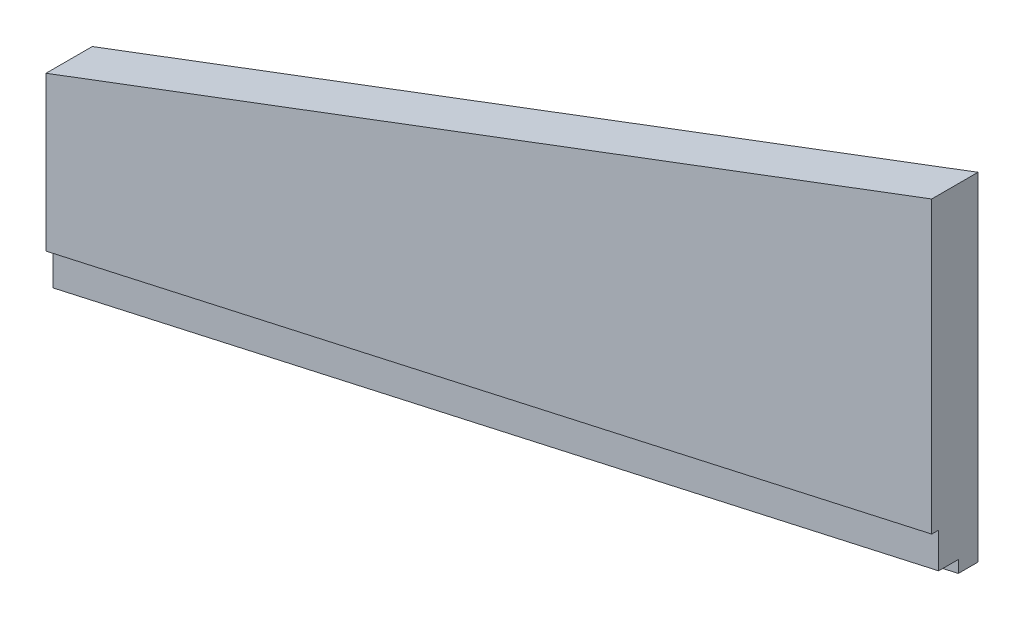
SolidWorks part; units mm, degrees
ref_plane "Спереди" through (0, 0, 0) normal (0, 0, 1) x (1, 0, 0)
ref_plane "Сверху" through (0, 0, 0) normal (0, 1, 0) x (1, 0, 0)
ref_plane "Справа" through (0, 0, 0) normal (1, 0, 0) x (0, 0, -1)
sketch "Эскиз1" plane through (0, 0, 0) normal (0, 0, 1) x (1, 0, 0)
  line L4 (0, -931.8468) -> (0, -1226.7384)
  line L6 (-900, -1271.2097) -> (-900, -1427.7191)
  line L21 (0, -931.8468) -> (-900, -1271.2097)
  line L23 (0, -1226.7384) -> (-900, -1427.7191)
extrude "Вытянуть1" add sketch "Эскиз1" along normal blind 47
sketch "Эскиз2" plane through (0, 0, 0) normal (0, 0, -1) x (-1, 0, 0)
  line L0 (0, -1226.7384) -> (0, -1262.6005)
  line L1 (900, -1427.7191) -> (900, -1463.5812)
  line L2 (900, -1463.5812) -> (0, -1262.6005)
  line L3 (900, -1427.7191) -> (0, -1226.7384) construction
  line L8 (900, -1271.2097) -> (0, -931.8468)
  line L9 (0, -931.8468) -> (0, -1226.7384)
  line L10 (0, -1226.7384) -> (900, -1427.7191)
  line L11 (900, -1427.7191) -> (900, -1271.2097)
  line L14 (0, -1226.7384) -> (900, -1427.7191)
  dimension "D1" = 35
  dimension "D2" = 0
extrude "Вытянуть2" add sketch "Эскиз2" against normal blind 40
sketch "Эскиз3" plane through (0, 0, 0) normal (0, 0, -1) x (-1, 0, 0)
  line L0 (0, -1262.6005) -> (0, -1274.8961)
  line L1 (900, -1463.5812) -> (900, -1475.8767)
  line L2 (900, -1475.8767) -> (0, -1274.8961)
  line L3 (0, -1262.6005) -> (900, -1463.5812) construction
  line L8 (900, -1271.2097) -> (0, -931.8468)
  line L9 (0, -931.8468) -> (0, -1262.6005)
  line L10 (0, -1262.6005) -> (900, -1463.5812)
  line L11 (900, -1463.5812) -> (900, -1271.2097)
  line L14 (0, -1262.6005) -> (900, -1463.5812)
  dimension "D1" = 12
  dimension "D2" = 0
extrude "Вытянуть3" add sketch "Эскиз3" against normal blind 20
